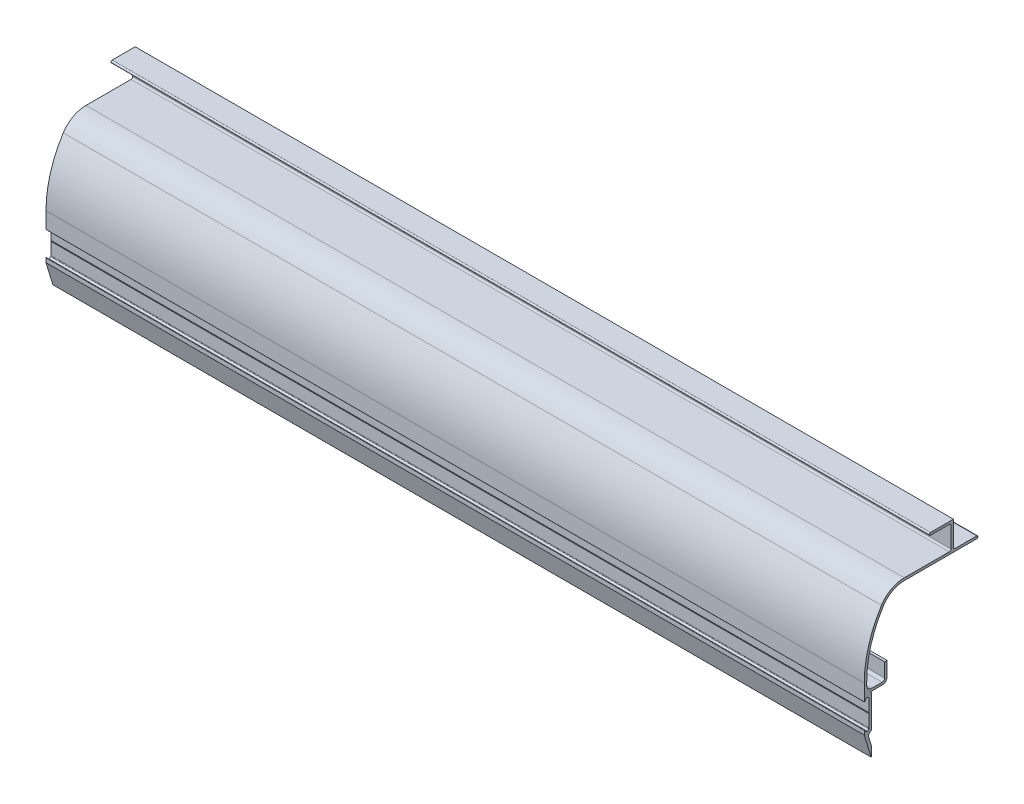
SolidWorks part; units mm, degrees
ref_plane "Front Plane" through (0, 0, 0) normal (0, 0, 1) x (1, 0, 0)
ref_plane "Top Plane" through (0, 0, 0) normal (0, 1, 0) x (1, 0, 0)
ref_plane "Right Plane" through (0, 0, 0) normal (1, 0, 0) x (0, 0, -1)
sketch "Sketch1" plane through (0, 0, 0) normal (1, 0, 0) x (0, 0, -1)
  line L0 (72, 201.4704) -> (100, 201.4704)
  line L1 (128.5, 166.4704) -> (39.8335, 166.4704)
  line L2 (39.8335, 169.4704) -> (95, 169.4704)
  line L3 (-6, 78.4704) -> (-6, 82.4704)
  line L4 (13, 72.4704) -> (0, 72.4704)
  line L5 (13, 69.4704) -> (-0.7637, 69.4704)
  line L7 (100, 201.4704) -> (100, 171.4704)
  line L8 (102, 169.4704) -> (128.5, 169.4704)
  line L9 (97, 171.4704) -> (97, 196.4704)
  line L10 (95, 198.4704) -> (72, 198.4704)
  line L11 (0, 28.435) -> (-2.5993, 26.5465)
  line L12 (-3.7049, 23.2423) -> (0, 11.1243)
  line L13 (0, 11.1243) -> (0, 0)
  line L14 (-0.5869, -0.0877) -> (-9, 27.4303)
  line L15 (-3.4122, 31.0608) -> (-5.2962, 29.692)
  line L16 (-9, 27.4303) -> (-9, 32.4504)
  line L17 (-8.4484, 32.6138) -> (-6.7227, 29.9564)
  line L18 (-3, 47.0603) -> (-2.5, 47.5603)
  line L19 (-3, 47.0603) -> (-3, 31.8699)
  line L20 (0, 47.5603) -> (0, 28.435)
  line L21 (-5.2962, 65.4286) -> (-3.4122, 64.0598)
  line L22 (-9, 62.6703) -> (-9, 82.4704)
  line L23 (-6.7227, 65.1643) -> (-8.4484, 62.5069)
  line L24 (-2.5, 47.5603) -> (-3, 48.0603)
  line L25 (-3, 63.2508) -> (-3, 48.0603)
  line L26 (0, 67.761) -> (0, 47.5603)
  line L27 (-1.0672, 68.5364) -> (0, 67.761)
  line L28 (16, 75.4704) -> (16, 92.4704)
  line L29 (16, 92.4704) -> (19, 92.4704)
  line L30 (19, 92.4704) -> (19, 75.4704)
  arc A0 (72, 201.4704) -> (72, 198.4704) centre (72, 199.9704) ccw
  arc A1 (14.5835, 152.6704) -> (-6, 82.4704) centre (124, 82.4704) ccw
  arc A2 (12.0586, 154.2904) -> (-9, 82.4704) centre (124, 82.4704) ccw
  arc A3 (128.5, 166.4704) -> (128.5, 169.4704) centre (128.5, 167.9704) ccw
  arc A4 (-0.7637, 69.4704) -> (-1.0672, 68.5364) centre (-0.7637, 68.9541) ccw
  arc A5 (-6, 78.4704) -> (0, 72.4704) centre (0, 78.4704) ccw
  arc A6 (97, 196.4704) -> (95, 198.4704) centre (95, 196.4704) ccw
  arc A7 (100, 171.4704) -> (102, 169.4704) centre (102, 171.4704) ccw
  arc A8 (95, 169.4704) -> (97, 171.4704) centre (95, 171.4704) ccw
  arc A9 (39.8335, 169.4704) -> (12.0586, 154.2904) centre (39.8335, 136.4704) ccw
  arc A10 (39.8335, 166.4704) -> (14.5835, 152.6704) centre (39.8335, 136.4704) ccw
  arc A11 (-0.5869, -0.0877) -> (0, 0) centre (-0.3, 0) ccw
  arc A12 (-8.4484, 32.6138) -> (-9, 32.4504) centre (-8.7, 32.4504) ccw
  arc A13 (-2.5993, 26.5465) -> (-3.7049, 23.2423) centre (-0.836, 24.1194) ccw
  arc A14 (-6.7227, 29.9564) -> (-5.2962, 29.692) centre (-5.884, 30.501) ccw
  arc A15 (-3.4122, 31.0608) -> (-3, 31.8699) centre (-4, 31.8699) ccw
  arc A16 (-9, 62.6703) -> (-8.4484, 62.5069) centre (-8.7, 62.6703) ccw
  arc A17 (-5.2962, 65.4286) -> (-6.7227, 65.1643) centre (-5.884, 64.6196) ccw
  arc A18 (-3, 63.2508) -> (-3.4122, 64.0598) centre (-4, 63.2508) ccw
  arc A19 (16, 75.4704) -> (13, 72.4704) centre (13, 75.4704) cw
  arc A20 (19, 75.4704) -> (13, 69.4704) centre (13, 75.4704) cw
  point P0 (124, 82.4704)
  dimension "D4" = 3
  dimension "D5" = 6
  dimension "D1" = 19
  dimension "D2" = 3
  dimension "D3" = 20
extrude "Extrude1" add sketch "Sketch1" along normal mid plane 1000
